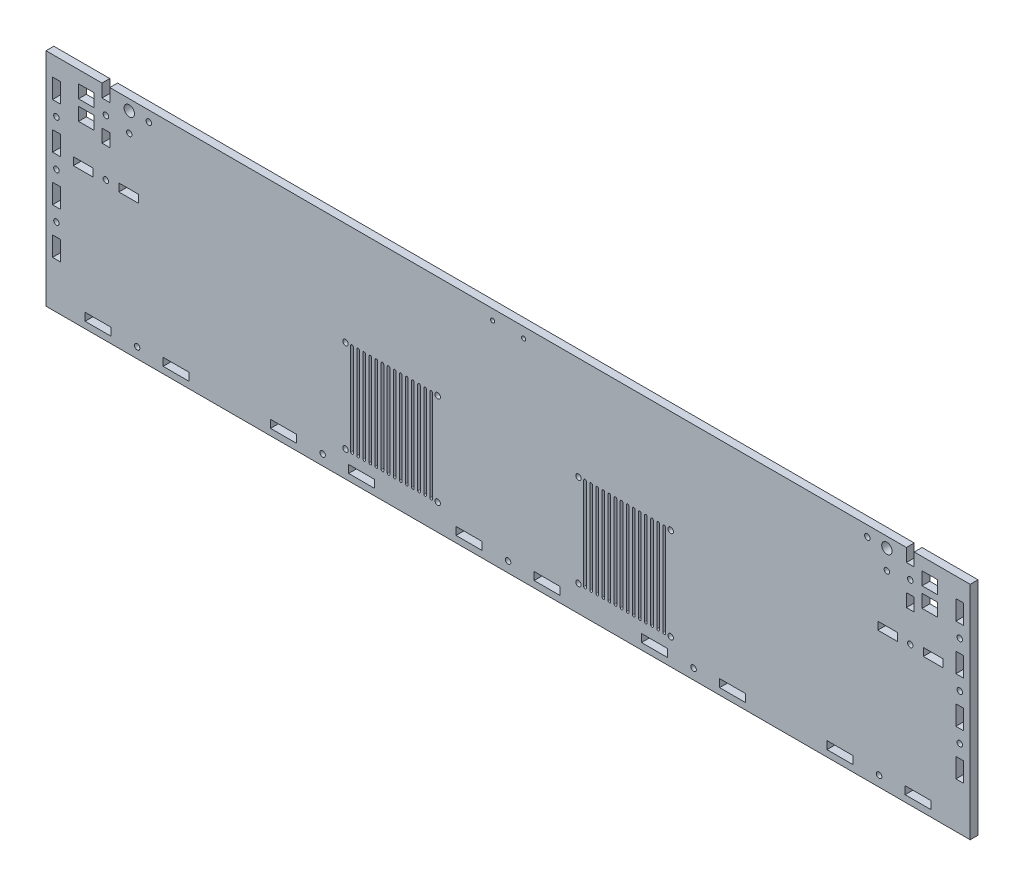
SolidWorks part; units mm, degrees
ref_plane "Спереди" through (0, 0, 0) normal (0, 0, 1) x (1, 0, 0)
ref_plane "Сверху" through (0, 0, 0) normal (0, 1, 0) x (1, 0, 0)
ref_plane "Справа" through (0, 0, 0) normal (1, 0, 0) x (0, 0, -1)
sketch "Эскиз1" plane through (0, 0, 0) normal (0, 0, 1) x (1, 0, 0)
  line L0 (355, 170) -> (355, 277.886) construction
  line L1 (0, 0) -> (710, 0)
  line L2 (0, 0) -> (0, 170)
  line L3 (0, 170) -> (710, 170)
  line L4 (710, 0) -> (710, 170)
  line L5 (5, 155) -> (11, 155)
  line L6 (5, 155) -> (5, 140)
  line L7 (5, 140) -> (11, 140)
  line L8 (11, 155) -> (11, 140)
  line L9 (5, 120) -> (11, 120)
  line L10 (5, 120) -> (5, 105)
  line L11 (5, 105) -> (11, 105)
  line L12 (11, 120) -> (11, 105)
  line L13 (5, 85) -> (11, 85)
  line L14 (5, 85) -> (5, 70)
  line L15 (5, 70) -> (11, 70)
  line L16 (11, 85) -> (11, 70)
  line L17 (5, 50) -> (11, 50)
  line L18 (5, 50) -> (5, 35)
  line L19 (5, 35) -> (11, 35)
  line L20 (11, 50) -> (11, 35)
  line L21 (699, 50) -> (699, 35)
  line L22 (705, 35) -> (699, 35)
  line L23 (705, 50) -> (705, 35)
  line L24 (705, 50) -> (699, 50)
  line L25 (699, 85) -> (699, 70)
  line L26 (705, 70) -> (699, 70)
  line L27 (705, 85) -> (705, 70)
  line L28 (705, 85) -> (699, 85)
  line L29 (699, 120) -> (699, 105)
  line L30 (705, 105) -> (699, 105)
  line L31 (705, 120) -> (705, 105)
  line L32 (705, 120) -> (699, 120)
  line L33 (699, 155) -> (699, 140)
  line L34 (705, 140) -> (699, 140)
  line L35 (705, 155) -> (705, 140)
  line L36 (705, 155) -> (699, 155)
  circle A0 centre (8, 130) radius 2.1
  circle A1 centre (8, 60) radius 2.1
  circle A2 centre (8, 95) radius 2.1
  circle A3 centre (702, 95) radius 2.1
  circle A4 centre (702, 60) radius 2.1
  circle A5 centre (702, 130) radius 2.1
  circle A6 centre (64, 162) radius 4
  circle A7 centre (64, 147) radius 2.1
  circle A8 centre (79, 162) radius 2.1
  circle A9 centre (631, 162) radius 2.1
  circle A10 centre (646, 147) radius 2.1
  circle A11 centre (646, 162) radius 4
  point P23 (8, 140)
  point P26 (8, 120)
  point P27 (8, 85)
  point P28 (8, 50)
  point P55 (702, 50)
  point P56 (702, 85)
  point P57 (702, 120)
  point P58 (702, 140)
extrude "Бобышка-Вытянуть1" add sketch "Эскиз1" along normal blind 6
sketch "Эскиз2" plane through (0, 0, 6) normal (0, 0, 1) x (1, 0, 0)
  line L0 (710, 170) -> (0, 170) construction
  line L1 (30, 11) -> (50, 11)
  line L2 (30, 11) -> (30, 5)
  line L3 (30, 5) -> (50, 5)
  line L4 (50, 11) -> (50, 5)
  line L5 (90, 11) -> (110, 11)
  line L6 (90, 11) -> (90, 5)
  line L7 (90, 5) -> (110, 5)
  line L8 (110, 11) -> (110, 5)
  line L9 (172.5, 11) -> (192.5, 11)
  line L10 (172.5, 11) -> (172.5, 5)
  line L11 (172.5, 5) -> (192.5, 5)
  line L12 (192.5, 11) -> (192.5, 5)
  line L13 (232.5, 11) -> (252.5, 11)
  line L14 (232.5, 11) -> (232.5, 5)
  line L15 (232.5, 5) -> (252.5, 5)
  line L16 (252.5, 11) -> (252.5, 5)
  line L17 (315, 11) -> (335, 11)
  line L18 (315, 11) -> (315, 5)
  line L19 (315, 5) -> (335, 5)
  line L20 (335, 11) -> (335, 5)
  line L21 (355, 170) -> (355, 191.4481) construction
  line L24 (375, 11) -> (375, 5)
  line L25 (395, 5) -> (375, 5)
  line L26 (395, 11) -> (395, 5)
  line L27 (395, 11) -> (375, 11)
  line L28 (457.5, 11) -> (457.5, 5)
  line L29 (477.5, 5) -> (457.5, 5)
  line L30 (477.5, 11) -> (477.5, 5)
  line L31 (477.5, 11) -> (457.5, 11)
  line L32 (517.5, 11) -> (517.5, 5)
  line L33 (537.5, 5) -> (517.5, 5)
  line L34 (537.5, 11) -> (537.5, 5)
  line L35 (537.5, 11) -> (517.5, 11)
  line L36 (600, 11) -> (600, 5)
  line L37 (620, 5) -> (600, 5)
  line L38 (620, 11) -> (620, 5)
  line L39 (620, 11) -> (600, 11)
  line L40 (660, 11) -> (660, 5)
  line L41 (680, 5) -> (660, 5)
  line L42 (680, 11) -> (680, 5)
  line L43 (680, 11) -> (660, 11)
  line L44 (0, 0) -> (710, 0) construction
  circle A0 centre (70, 8) radius 2.1
  circle A1 centre (212.5, 8) radius 2.1
  circle A2 centre (355, 8) radius 2.1
  circle A3 centre (497.5, 8) radius 2.1
  circle A4 centre (640, 8) radius 2.1
  point P26 (355, 170)
  point P31 (335, 8)
  point P32 (252.5, 8)
  point P35 (192.5, 8)
  point P36 (110, 8)
  point P37 (50, 8)
  point P64 (660, 8)
  point P65 (600, 8)
  point P66 (517.5, 8)
  point P67 (457.5, 8)
  point P68 (375, 8)
extrude "Вырез-Вытянуть1" cut sketch "Эскиз2" against normal through all
sketch "Эскиз3" plane through (0, 0, 6) normal (0, 0, 1) x (1, 0, 0)
  line L0 (710, 170) -> (0, 170) construction
  line L1 (43, 170) -> (49, 170)
  line L2 (43, 170) -> (43, 160)
  line L3 (43, 160) -> (49, 160)
  line L4 (49, 170) -> (49, 160)
  line L5 (43, 140) -> (49, 140)
  line L6 (43, 140) -> (43, 130)
  line L7 (43, 130) -> (49, 130)
  line L8 (49, 140) -> (49, 130)
  line L9 (31, 150.5) -> (31, 145.5) construction
  line L10 (355, 170) -> (355, 261.8065) construction
  line L11 (25, 160.5) -> (37, 160.5)
  line L12 (25, 160.5) -> (25, 150.5)
  line L13 (25, 150.5) -> (37, 150.5)
  line L14 (37, 160.5) -> (37, 150.5)
  line L15 (25, 145.5) -> (37, 145.5)
  line L16 (25, 145.5) -> (25, 135.5)
  line L17 (25, 135.5) -> (37, 135.5)
  line L18 (37, 145.5) -> (37, 135.5)
  line L19 (673, 145.5) -> (673, 135.5)
  line L20 (685, 135.5) -> (673, 135.5)
  line L21 (685, 145.5) -> (685, 135.5)
  line L22 (685, 145.5) -> (673, 145.5)
  line L23 (673, 160.5) -> (673, 150.5)
  line L24 (685, 150.5) -> (673, 150.5)
  line L25 (685, 160.5) -> (685, 150.5)
  line L26 (685, 160.5) -> (673, 160.5)
  line L27 (661, 140) -> (661, 130)
  line L28 (667, 130) -> (661, 130)
  line L29 (667, 140) -> (667, 130)
  line L30 (667, 140) -> (661, 140)
  line L31 (661, 170) -> (661, 160)
  line L32 (667, 160) -> (661, 160)
  line L33 (667, 170) -> (667, 160)
  line L34 (667, 170) -> (661, 170)
  line L35 (705, 105) -> (705, 120) construction
  line L36 (705, 120) -> (699, 120) construction
  circle A0 centre (46, 150) radius 2.1
  circle A1 centre (664, 150) radius 2.1
  point P10 (46, 160)
  point P11 (46, 140)
  point P14 (64, 162)
  point P46 (685, 140.5)
  point P47 (685, 155.5)
  point P48 (646, 162)
  point P49 (664, 140)
  point P50 (664, 160)
  point P53 (31, 148)
extrude "Вырез-Вытянуть2" cut sketch "Эскиз3" against normal through all
sketch "Эскиз4" plane through (0, 0, 6) normal (0, 0, 1) x (1, 0, 0)
  line L0 (43, 130) -> (49, 130) construction
  line L1 (21, 110) -> (36, 110)
  line L2 (21, 110) -> (21, 104)
  line L3 (21, 104) -> (36, 104)
  line L4 (36, 110) -> (36, 104)
  line L5 (56, 110) -> (71, 110)
  line L6 (56, 110) -> (56, 104)
  line L7 (56, 104) -> (71, 104)
  line L8 (71, 110) -> (71, 104)
  line L9 (355, 170) -> (355, 253.3939) construction
  line L10 (661, 170) -> (49, 170) construction
  line L11 (639, 110) -> (639, 104)
  line L12 (654, 104) -> (639, 104)
  line L13 (654, 110) -> (654, 104)
  line L14 (654, 110) -> (639, 110)
  line L15 (674, 110) -> (674, 104)
  line L16 (689, 104) -> (674, 104)
  line L17 (689, 110) -> (689, 104)
  line L18 (689, 110) -> (674, 110)
  circle A0 centre (46, 107) radius 2.1
  circle A1 centre (664, 107) radius 2.1
  point P10 (46, 130)
  point P11 (36, 107)
  point P14 (56, 107)
  point P29 (654, 107)
  point P30 (674, 107)
  point P31 (664, 130)
extrude "Вырез-Вытянуть3" cut sketch "Эскиз4" against normal through all
sketch "Эскиз5" plane through (0, 0, 6) normal (0, 0, 1) x (1, 0, 0)
  line L0 (661, 170) -> (49, 170) construction
  circle A0 centre (343.1, 162) radius 1.6
  circle A1 centre (366.9, 162) radius 1.6
  point P6 (355, 170)
extrude "Вырез-Вытянуть4" cut sketch "Эскиз5" against normal through all
sketch "Эскиз6" plane through (0, 0, 6) normal (0, 0, 1) x (1, 0, 0)
  line L0 (661, 170) -> (49, 170) construction
  line L1 (252.5, 11) -> (232.5, 11) construction
  line L2 (226, 95) -> (305, 95) construction
  line L3 (226, 95) -> (226, 16) construction
  line L4 (226, 16) -> (305, 16) construction
  line L5 (305, 95) -> (305, 16) construction
  line L6 (355, 170) -> (355, 204.1442) construction
  line L7 (228, 93) -> (303, 93) construction
  line L8 (228, 93) -> (228, 18) construction
  line L9 (228, 18) -> (303, 18) construction
  line L10 (303, 93) -> (303, 18) construction
  line L11 (407, 93) -> (407, 18) construction
  line L12 (482, 18) -> (407, 18) construction
  line L13 (482, 93) -> (482, 18) construction
  line L14 (482, 93) -> (407, 93) construction
  line L15 (405, 95) -> (405, 16) construction
  line L16 (484, 16) -> (405, 16) construction
  line L17 (484, 95) -> (484, 16) construction
  line L18 (484, 95) -> (405, 95) construction
  circle A0 centre (230.1, 90.9) radius 2.1
  circle A1 centre (300.9, 90.9) radius 2.1
  circle A2 centre (230.1, 20.1) radius 2.1
  circle A3 centre (300.9, 20.1) radius 2.1
  circle A4 centre (409.1, 20.1) radius 2.1
  circle A5 centre (479.9, 20.1) radius 2.1
  circle A6 centre (409.1, 90.9) radius 2.1
  circle A7 centre (479.9, 90.9) radius 2.1
  point P16 (355, 170)
  point P21 (230.1, 93)
  point P22 (228, 90.9)
  point P23 (300.9, 93)
  point P24 (303, 90.9)
  point P25 (303, 20.1)
  point P26 (300.9, 18)
  point P27 (230.1, 18)
  point P28 (228, 20.1)
  point P47 (482, 20.1)
  point P48 (479.9, 18)
  point P49 (409.1, 18)
  point P50 (407, 20.1)
  point P51 (407, 90.9)
  point P52 (409.1, 93)
  point P53 (482, 90.9)
  point P54 (479.9, 93)
  dimension "D1" = 79
  dimension "D5" = 4.2
  dimension "D2" = 79
  dimension "D3" = 5
  dimension "D4" = 50
  dimension "D6" = 2
  dimension "D7" = 2
  dimension "D8" = 2
  dimension "D9" = 2
extrude "Вырез-Вытянуть5" cut sketch "Эскиз6" against normal through all
sketch "Эскиз7" plane through (0, 0, 6) normal (0, 0, 1) x (1, 0, 0)
  line L0 (230.1, 90.9) -> (300.9, 90.9) construction
  line L1 (230.1, 20.1) -> (300.9, 20.1) construction
  line L2 (235.1, 90.9) -> (235.1, 20.1) construction
  line L3 (236.1, 90.9) -> (236.1, 20.1)
  line L4 (234.1, 90.9) -> (234.1, 20.1)
  arc A0 (236.1, 90.9) -> (234.1, 90.9) centre (235.1, 90.9) ccw
  arc A1 (234.1, 20.1) -> (236.1, 20.1) centre (235.1, 20.1) ccw
  point P10 (235.1, 55.5)
  dimension "D1" = 2
  dimension "D2" = 5
extrude "Вырез-Вытянуть6" cut sketch "Эскиз7" against normal through all
sketch "Эскиз8" plane through (0, 0, 6) normal (0, 0, 1) x (1, 0, 0)
  line L0 (230.1, 90.9) -> (295.9, 90.9) construction
  point P4 (300.9, 90.9)
  dimension "D1" = 5
pattern_curve "Кривая1" of "Вырез-Вытянуть6" parameters "D1"=14, "D3"=50, "D2"=1, "D4"=50
sketch "Эскиз9" plane through (0, 0, 6) normal (0, 0, 1) x (1, 0, 0)
  line L0 (409.1, 90.9) -> (479.9, 90.9) construction
  line L1 (409.1, 20.1) -> (479.9, 20.1) construction
  line L2 (414.1, 90.9) -> (414.1, 20.1) construction
  line L3 (415.1, 90.9) -> (415.1, 20.1)
  line L4 (413.1, 90.9) -> (413.1, 20.1)
  arc A0 (415.1, 90.9) -> (413.1, 90.9) centre (414.1, 90.9) ccw
  arc A1 (413.1, 20.1) -> (415.1, 20.1) centre (414.1, 20.1) ccw
  point P10 (414.1, 55.5)
  dimension "D1" = 2
  dimension "D2" = 5
extrude "Вырез-Вытянуть7" cut sketch "Эскиз9" against normal through all
sketch "Эскиз10" plane through (0, 0, 6) normal (0, 0, 1) x (1, 0, 0)
  line L0 (409.1, 90.9) -> (474.9, 90.9) construction
  point P3 (479.9, 90.9)
  dimension "D1" = 5
pattern_curve "Кривая2" of "Вырез-Вытянуть7" parameters "D1"=14, "D3"=50, "D2"=1, "D4"=50
equation "\"D17@Эскиз1\"=\"D6@Эскиз1\"/2"
equation "\"D18@Эскиз1\"=\"D11@Эскиз1\"/2"
equation "\"D19@Эскиз1\"=\"D12@Эскиз1\"/2"
equation "\"D16@Эскиз2\"=\"D15@Эскиз2\"/2"
equation "\"D18@Эскиз2\"=\"D17@Эскиз2\"/2"
equation "\"D20@Эскиз2\"=\"D19@Эскиз2\"/2"
equation "\"D9@Эскиз3\"=\"D3@Эскиз3\"/2"
equation "\"D3@Эскиз4\"=\"D2@Эскиз4\"/2"
equation "\"D4@Эскиз5\"=\"D2@Эскиз5\"/2"
